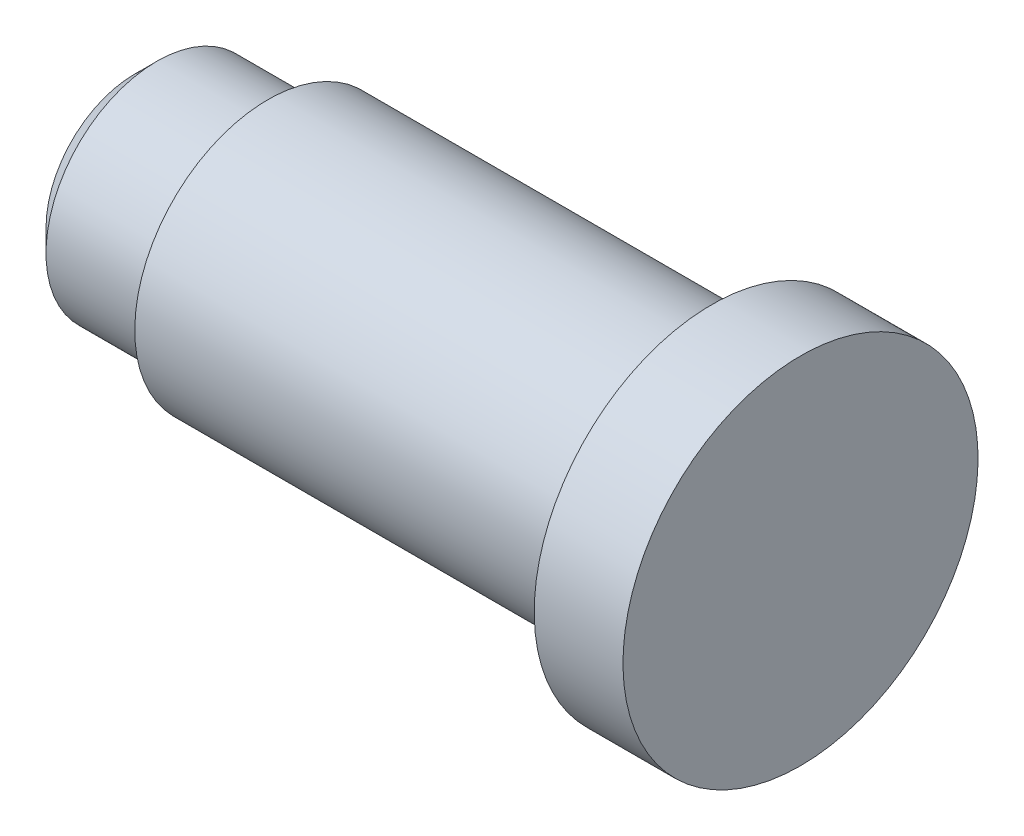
SolidWorks part; units mm, degrees
ref_plane "Plan de face" through (0, 0, 0) normal (0, 0, 1) x (1, 0, 0)
ref_plane "Plan de dessus" through (0, 0, 0) normal (0, 1, 0) x (1, 0, 0)
ref_plane "Plan de droite" through (0, 0, 0) normal (1, 0, 0) x (0, 0, -1)
sketch "Esquisse1" plane through (0, 0, 0) normal (0, 0, 1) x (1, 0, 0)
  line L0 (-21.7407, 0) -> (-6.7407, 0)
  line L1 (-8.7407, 3) -> (-8.7407, 4)
  line L2 (-8.7407, 3) -> (-18.7407, 3)
  line L3 (-18.7407, 3) -> (-18.7407, 2.5)
  line L4 (-18.7407, 2.5) -> (-21.2407, 2.5)
  line L5 (-21.2407, 2.5) -> (-21.7407, 2)
  line L6 (-21.7407, 2) -> (-21.7407, 0)
  line L7 (-8.7407, 4) -> (-6.7407, 4)
  line L8 (-6.7407, 4) -> (-6.7407, 0)
  dimension "D1" = 4
  dimension "D2" = 10
  dimension "D3" = 2.5
  dimension "D4" = 135
  dimension "D5" = 3
  dimension "D6" = 2
  dimension "D7" = 3
  dimension "D8" = 2
revolve "Révolution1" add sketch "Esquisse1" angle 360 about L0
